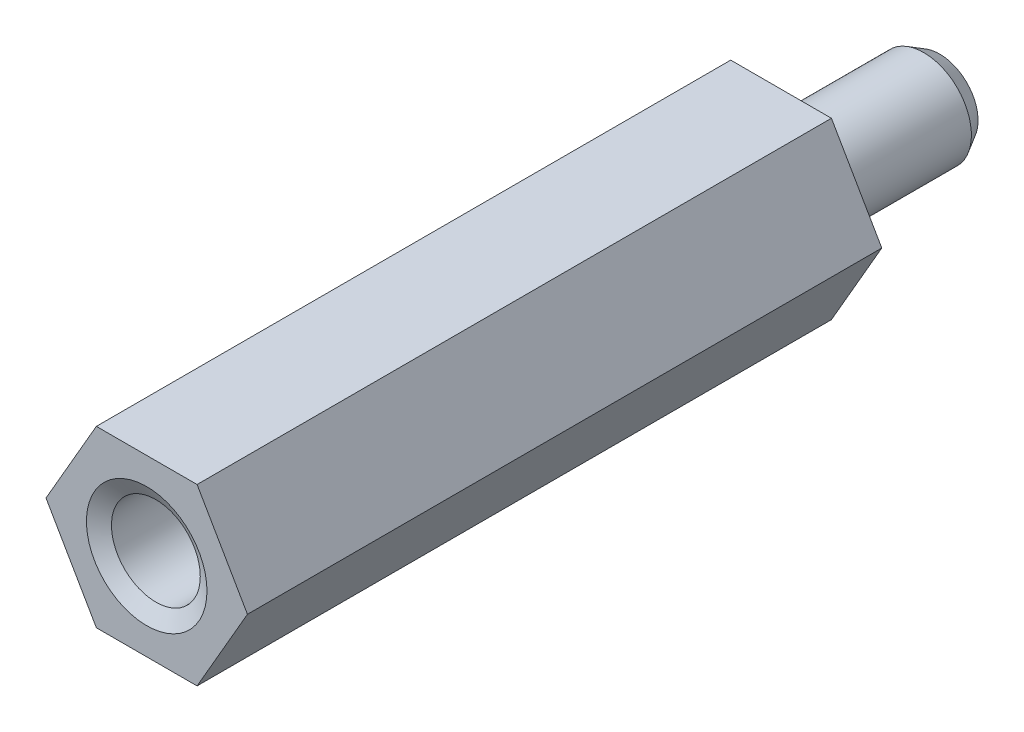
SolidWorks part; units mm, degrees
ref_plane "Front Plane" through (0, 0, 0) normal (0, 0, 1) x (1, 0, 0)
ref_plane "Top Plane" through (0, 0, 0) normal (0, 1, 0) x (1, 0, 0)
ref_plane "Right Plane" through (0, 0, 0) normal (1, 0, 0) x (0, 0, -1)
sketch "Sketch1" plane through (0, 0, 0) normal (0, 0, 1) x (1, 0, 0)
  line L1 (1.5877, 2.75) -> (-1.5877, 2.75)
  line L2 (-1.5877, 2.75) -> (-3.1754, 0)
  line L3 (-3.1754, 0) -> (-1.5877, -2.75)
  line L4 (-1.5877, -2.75) -> (1.5877, -2.75)
  line L5 (1.5877, -2.75) -> (3.1754, 0)
  line L6 (3.1754, 0) -> (1.5877, 2.75)
  circle A0 centre (0, 0) radius 2.75 construction
  dimension "D1" = 5.5
extrude "Boss-Extrude1" add sketch "Sketch1" along normal blind 20
sketch "Sketch2" plane through (0, 0, 0) normal (0, 0, -1) x (-1, 0, 0)
  circle A0 centre (0, 0) radius 1.5
  dimension "D1" = 3
extrude "Boss-Extrude2" add sketch "Sketch2" along normal blind 5
chamfer "Chamfer1" distance 0.5 angle 30 1 edges at (-1.5, 0, -5)
sketch "Sketch3" plane through (0, 0, 20) normal (0, 0, 1) x (1, 0, 0)
  circle A0 centre (0, 0) radius 1.4
  dimension "D1" = 2.8
extrude "Cut-Extrude1" cut sketch "Sketch3" against normal blind 6
chamfer "Chamfer2" distance 1.2 angle 30 1 edges at (1.4, 0, 14)
chamfer "Chamfer3" distance 0.5 angle 30 1 edges at (1.4, 0, 20)
